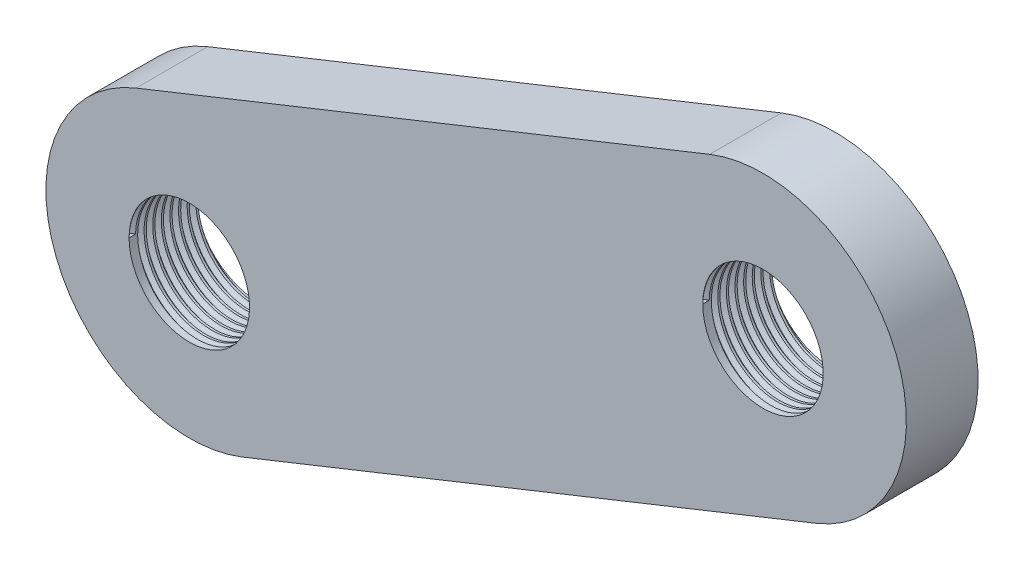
SolidWorks part; units mm, degrees
ref_plane "Alzado" through (0, 0, 0) normal (0, 0, 1) x (1, 0, 0)
ref_plane "Planta" through (0, 0, 0) normal (0, 1, 0) x (1, 0, 0)
ref_plane "Vista lateral" through (0, 0, 0) normal (1, 0, 0) x (0, 0, -1)
ref_plane "Plano1" through (0, 0, 51.9) normal (0, 0, 1) x (1, 0, 0)
sketch "Sk_Biela_interior" plane through (0, 0, 51.9) normal (0, 0, 1) x (1, 0, 0)
  line L0 (-42.143, -54.6424) -> (-22.143, -46.6424)
  line L1 (-25.857, -37.3576) -> (-45.857, -45.3576)
  arc A0 (-22.143, -46.6424) -> (-25.857, -37.3576) centre (-24, -42) ccw
  arc A1 (-45.857, -45.3576) -> (-42.143, -54.6424) centre (-44, -50) ccw
  circle A2 centre (-24, -42) radius 2.1
  circle A3 centre (-44, -50) radius 2.1
extrude "Biela_interior" add sketch "Sk_Biela_interior" along normal blind 2.5
thread "Rosca1" pitch 0.3 start angle 0, offset 0, length 0, pitch 0.3, diameter 4.2
ref_plane "Plano2" through (-26.1, -42, 54.4) normal (0, -1, 0) x (-1, 0, 0)
sketch "Perfil de rosca1" plane through (-26.1, -42, 54.4) normal (0, -1, 0) x (-1, 0, 0)
  line L0 (0, 0) -> (0, 0.3) construction
  line L1 (0, 0) -> (0.1624, 0.0937)
  line L2 (0.1624, 0.0937) -> (0.1624, 0.1312)
  line L3 (0.1624, 0.1312) -> (0, 0.225)
  line L4 (0.1624, 0.1125) -> (0, 0.1125) construction
  line L11 (0, 0) -> (0, 0.225)
  point P2 (0, 0)
  dimension "Pitch" = 0.3
  dimension "Profile_Angle" = 60
  dimension "Profile_Land" = 0.0375
  dimension "Profile_Height" = 0.1624
thread "Rosca2" pitch 0.3 start angle 0, offset 0, length 0, pitch 0.3, diameter 4.2
ref_plane "Plano3" through (-46.1, -50, 54.4) normal (0, -1, 0) x (-1, 0, 0)
sketch "Perfil de rosca2" plane through (-46.1, -50, 54.4) normal (0, -1, 0) x (-1, 0, 0)
  line L0 (0, 0) -> (0, 0.3) construction
  line L1 (0, 0) -> (0.1624, 0.0937)
  line L2 (0.1624, 0.0937) -> (0.1624, 0.1312)
  line L3 (0.1624, 0.1312) -> (0, 0.225)
  line L4 (0.1624, 0.1125) -> (0, 0.1125) construction
  line L11 (0, 0) -> (0, 0.225)
  point P2 (0, 0)
  dimension "Pitch" = 0.3
  dimension "Profile_Angle" = 60
  dimension "Profile_Land" = 0.0375
  dimension "Profile_Height" = 0.1624
